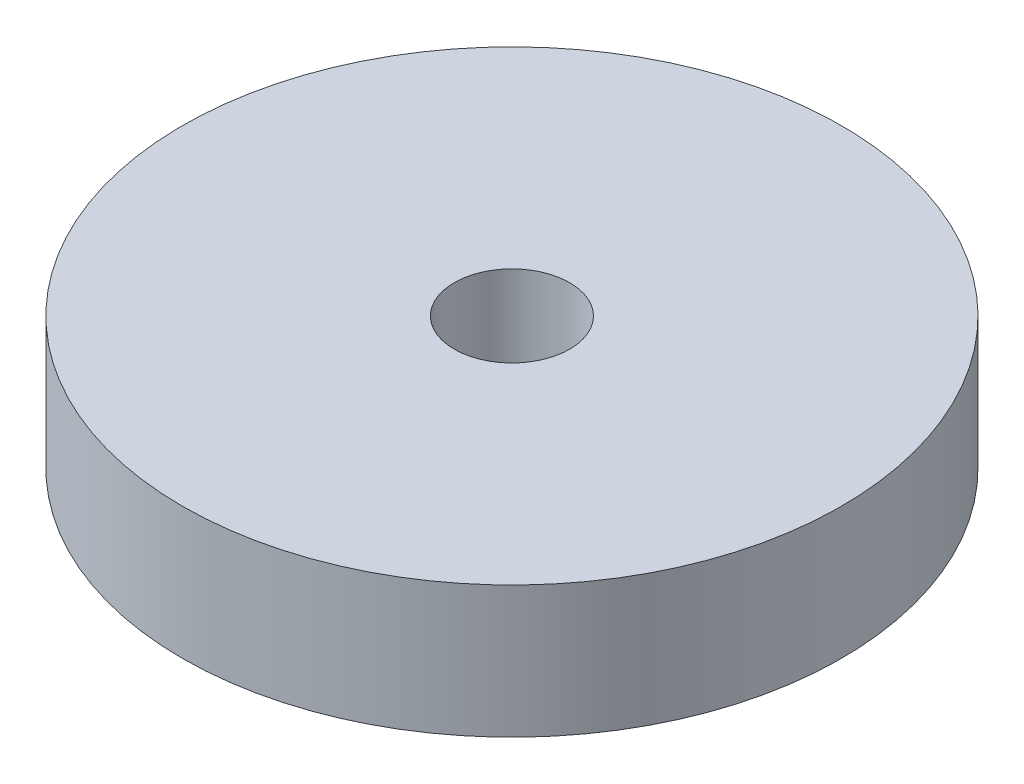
SolidWorks part; units mm, degrees
ref_plane "Front Plane" through (0, 0, 0) normal (0, 0, 1) x (1, 0, 0)
ref_plane "Top Plane" through (0, 0, 0) normal (0, 1, 0) x (1, 0, 0)
ref_plane "Right Plane" through (0, 0, 0) normal (1, 0, 0) x (0, 0, -1)
sketch "Sketch1" plane through (0, 0, 0) normal (0, 1, 0) x (1, 0, 0)
  circle A0 centre (0, 0) radius 10
  circle A1 centre (0, 0) radius 1.75
extrude "Extrude1" add sketch "Sketch1" along normal blind 4
